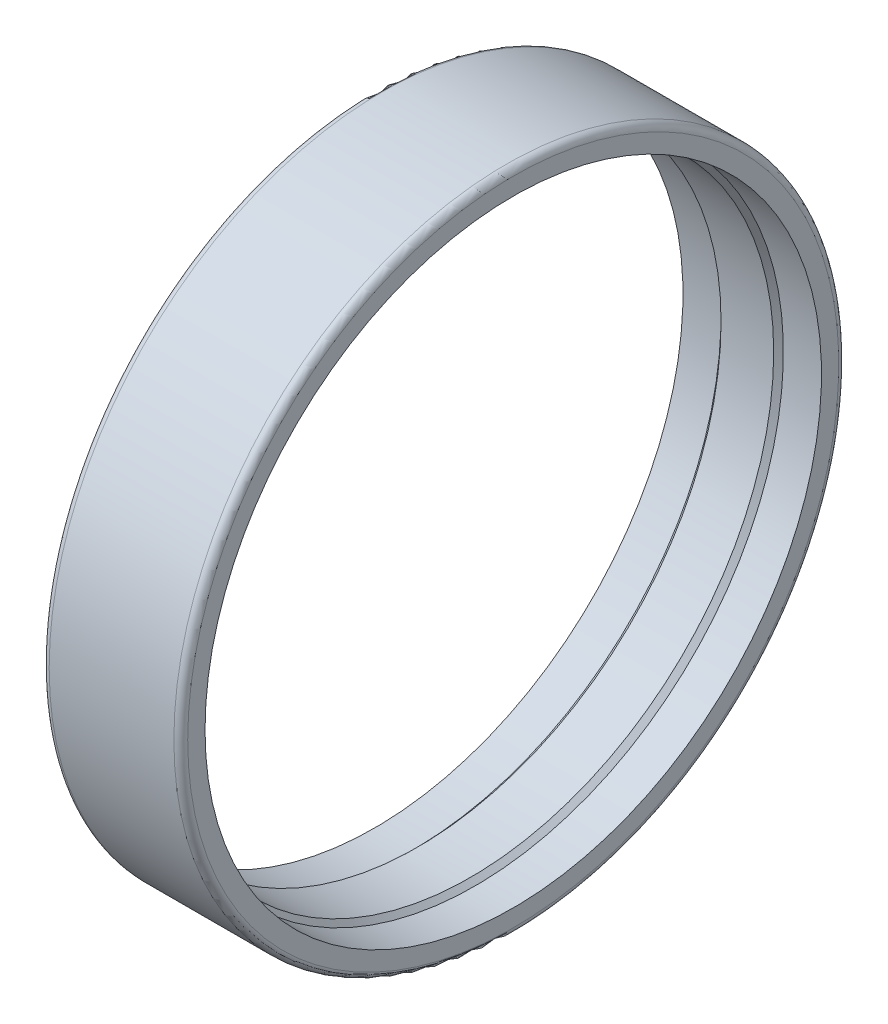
SolidWorks part; units mm, degrees
ref_plane "Alzado" through (0, 0, 0) normal (0, 0, 1) x (1, 0, 0)
ref_plane "Planta" through (0, 0, 0) normal (0, 1, 0) x (1, 0, 0)
ref_plane "Vista lateral" through (0, 0, 0) normal (1, 0, 0) x (0, 0, -1)
sketch "Croquis1" plane through (0, 0, 0) normal (0, 0, 1) x (1, 0, 0)
  line L0 (0, 0) -> (17.5969, 0) construction
  line L1 (0, 43.8) -> (4.5, 43.8)
  line L2 (4.5, 43.8) -> (4.5, 44.5)
  line L3 (4.5, 44.5) -> (10, 44.5)
  line L4 (10, 44.5) -> (10, 48)
  line L5 (10, 48) -> (-10, 48)
  line L6 (-10, 48) -> (-10, 44.5)
  line L7 (-10, 44.5) -> (-4.5, 44.5)
  line L8 (-4.5, 44.5) -> (-4.5, 43.8)
  line L9 (-4.5, 43.8) -> (0, 43.8)
  point P13 (-4.5, 44.15)
  point P14 (0, 48)
  dimension "D1" = 43.8
  dimension "D2" = 4.5
  dimension "D3" = 9
  dimension "D4" = 44.5
  dimension "D5" = 48
  dimension "D6" = 20
  dimension "D7" = 44.5
revolve "Revolución1" add sketch "Croquis1" angle 360 about L0
ref_plane "Plano1" through (0, 0, -48) normal (0, 0, -1) x (-1, 0, 0)
sketch "Croquis2" plane through (0, 0, -48) normal (0, 0, -1) x (-1, 0, 0)
  line L0 (-10, -4.773) -> (-0.4541, 4.773) construction
  line L1 (-10, 48) -> (-10, -48) construction
  line L2 (0, 0) -> (-10, 0) construction
  line L3 (-0.4541, 4.773) -> (-1.3379, 5.6569)
  line L4 (-1.3379, 5.6569) -> (-10, -3.0052)
  line L5 (-10, -3.0052) -> (-10, -6.5407)
  line L6 (-10, -6.5407) -> (0.4298, 3.8891)
  line L7 (0.4298, 3.8891) -> (-0.4541, 4.773)
  line L8 (-10, -6.5407) -> (10, -6.5407) construction
  line L9 (10, -48) -> (10, 48) construction
  line L10 (-10, -4.773) -> (10, -4.773) construction
  line L11 (10, -4.773) -> (-0.4298, 5.6569)
  line L12 (-0.4298, 5.6569) -> (1.3379, 7.4246)
  line L13 (1.3379, 7.4246) -> (10, -1.2374)
  line L14 (10, -1.2374) -> (10, -4.773)
  line L15 (0.4541, 6.5407) -> (10, -3.0052) construction
  point P4 (-5.227, 0)
  dimension "D1" = 13.5
  dimension "D2" = 45
  dimension "D3" = 1.25
  dimension "D4" = 2.5
  dimension "D5" = 13.5
  dimension "D6" = 2.5
  dimension "D7" = 45
chamfer "Chaflán2" distance 0.7 angle 45
chamfer "Chaflán3" distance 0.7 angle 45
fillet "Redondeo1" radius 1
